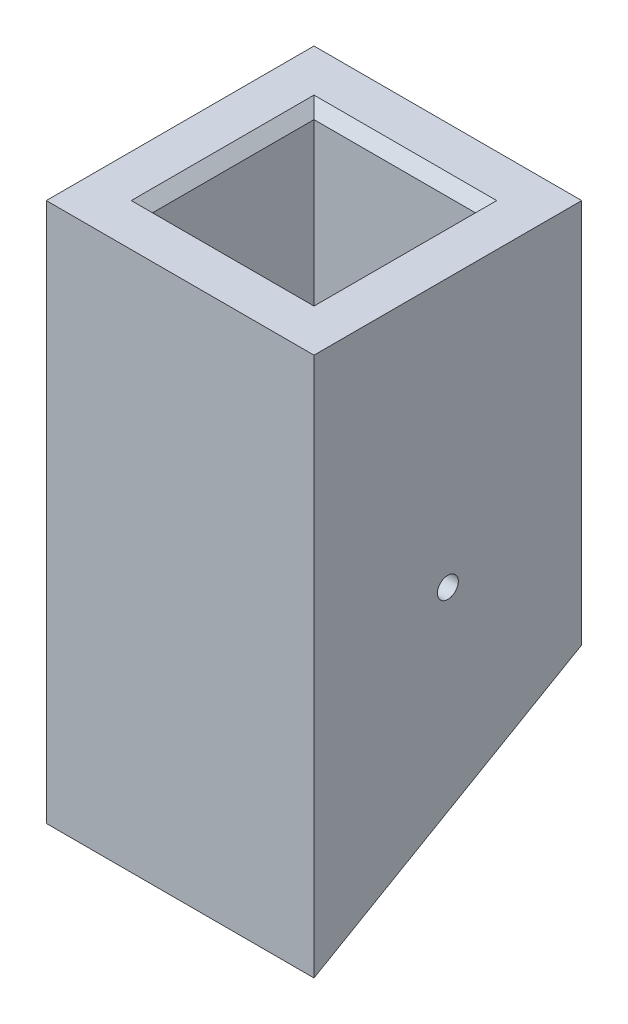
SolidWorks part; units mm, degrees
ref_plane "Front Plane" through (0, 0, 0) normal (0, 0, 1) x (1, 0, 0)
ref_plane "Top Plane" through (0, 0, 0) normal (0, 1, 0) x (1, 0, 0)
ref_plane "Right Plane" through (0, 0, 0) normal (1, 0, 0) x (0, 0, -1)
sketch "Sketch1" plane through (0, 0, 0) normal (0, 1, 0) x (1, 0, 0)
  line L0 (-16.002, 16.002) -> (-16.002, -16.002)
  line L1 (-9.652, 9.652) -> (9.652, 9.652)
  line L2 (-9.652, 9.652) -> (-9.652, -9.652)
  line L3 (-9.652, -9.652) -> (9.652, -9.652)
  line L4 (9.652, 9.652) -> (9.652, -9.652)
  line L5 (-9.652, 9.652) -> (9.652, -9.652) construction
  line L6 (-9.652, -9.652) -> (9.652, 9.652) construction
  line L7 (-16.002, -16.002) -> (16.002, -16.002)
  line L8 (16.002, 16.002) -> (16.002, -16.002)
  line L9 (-16.002, 16.002) -> (16.002, 16.002)
  point P0 (0, 0)
  dimension "D1" = 19.304
  dimension "D2" = 6.35
extrude "Boss-Extrude1" add sketch "Sketch1" along normal blind 57.15 contours L9 L0 L7 L8 L1 L4 L3 L2
sketch "Sketch2" plane through (16.002, 0, 0) normal (1, 0, 0) x (0, 0, -1)
  line L0 (-16.002, 0) -> (16.002, 18.4775)
  line L1 (16.002, 57.15) -> (16.002, 0) construction
  line L2 (16.002, 0) -> (-16.002, 0) construction
  dimension "D1" = 30
extrude "Cut-Extrude1" cut sketch "Sketch2" against normal blind 57.15 and the other way through all contours L0 M2 M3
sketch "Sketch3" plane through (16.002, 0, 0) normal (1, 0, 0) x (0, 0, -1)
  line L0 (0, 9.2388) -> (0, 25.1138) construction
  line L1 (16.002, 18.4775) -> (-16.002, 0) construction
  circle A0 centre (0, 25.1138) radius 1.25
  dimension "D2" = 2.5
  dimension "D1" = 15.875
extrude "Cut-Extrude2" cut sketch "Sketch3" against normal blind 57.15
sketch "Sketch5" plane through (16.002, 0, 0) normal (1, 0, 0) x (0, 0, -1)
  line L0 (-16.002, -7.3323) -> (16.002, 11.1452)
  line L1 (16.002, 11.1452) -> (16.002, 18.4775)
  line L2 (-16.002, 0) -> (-16.002, -7.3323)
  line L3 (16.002, 18.4775) -> (-16.002, 0) construction
  line L8 (-16.002, 0) -> (16.002, 18.4775)
  line L9 (16.002, 18.4775) -> (16.002, 57.15)
  line L10 (16.002, 57.15) -> (-16.002, 57.15)
  line L11 (-16.002, 57.15) -> (-16.002, 0)
  line L12 (-16.002, 0) -> (16.002, 18.4775)
  point P7 (-15.5795, -3.2993)
  point P9 (-15.875, 0)
  dimension "D1" = 6.35
  dimension "D2" = 0
extrude "Boss-Extrude3" add sketch "Sketch5" against normal up to surface (32.004 mm away)
chamfer "Chamfer1" distance 1.27 angle 45 4 edges at (9.652, 57.15, 0) (0, 57.15, 9.652) (-9.652, 57.15, 0) (0, 57.15, -9.652)
